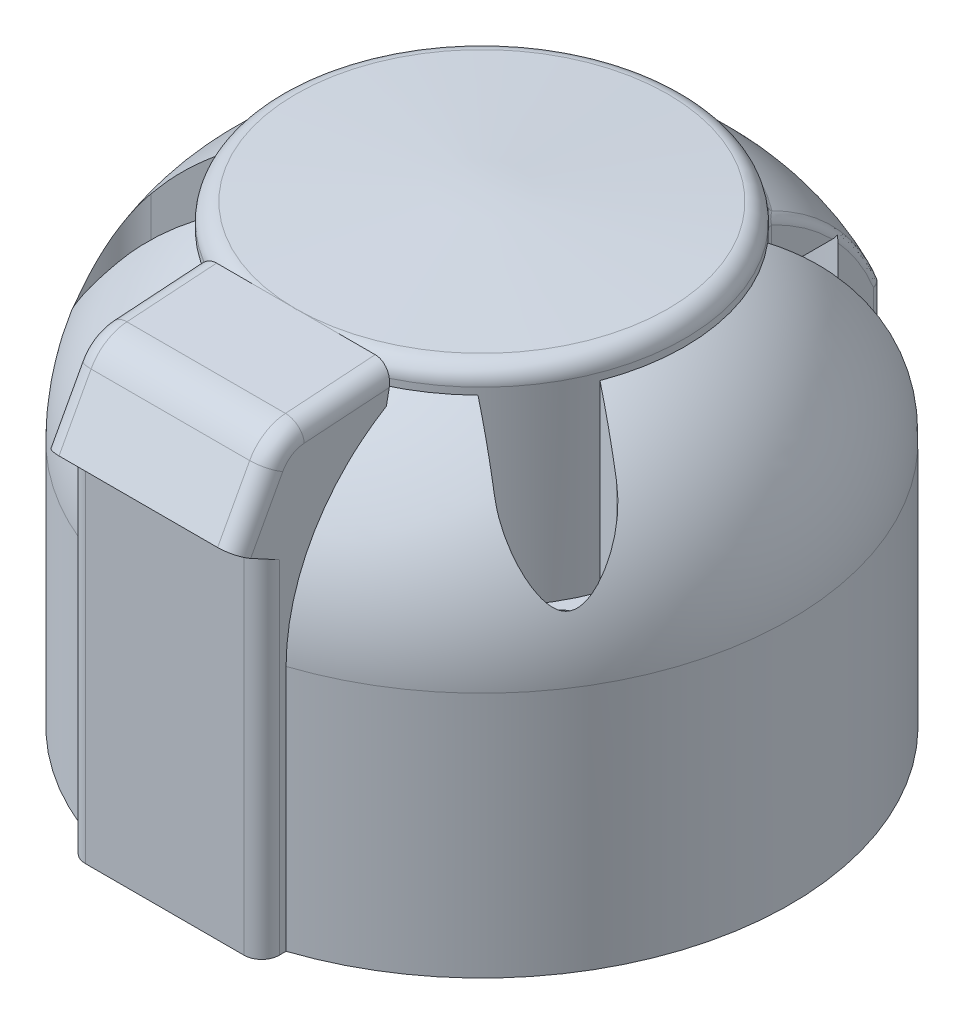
SolidWorks part; units mm, degrees
ref_plane "Face" through (0, 0, 0) normal (0, 0, 1) x (1, 0, 0)
ref_plane "Dessus" through (0, 0, 0) normal (0, 1, 0) x (1, 0, 0)
ref_plane "Droite" through (0, 0, 0) normal (1, 0, 0) x (0, 0, -1)
sketch "Esquisse1" plane through (0, 0, 0) normal (0, 0, 1) x (1, 0, 0)
  line L0 (0, 0) -> (35, 0)
  line L1 (35, 0) -> (35, 28)
  line L2 (23, 48.805) -> (23, 49.5937)
  line L3 (21.1143, 51.5904) -> (0, 53)
  line L4 (0, 53) -> (0, 0) construction
  line L5 (0, 0) -> (0, 53)
  arc A0 (35, 28) -> (23, 48.805) centre (10.9646, 28) ccw
  arc A1 (23, 49.5937) -> (21.1143, 51.5904) centre (21, 49.5937) ccw
  dimension "D5" = 2
  dimension "D1" = 35
  dimension "D2" = 28
  dimension "D3" = 53
  dimension "D4" = 23
revolve "Révolution1" add sketch "Esquisse1" angle 360 about L4
sketch "Esquisse2" plane through (0, 0, 0) normal (1, 0, 0) x (0, 0, -1)
  line L0 (-31.2808, 0) -> (-36, 0)
  line L1 (-35, 0) -> (35, 0) construction
  line L2 (-36, 0) -> (-36, 39.9562)
  line L3 (-36, 39.9562) -> (-39, 41.5809)
  line L4 (-39, 41.5809) -> (-35.3597, 48.3028)
  line L5 (-21.1143, 51.5904) -> (-31.2961, 50.9107)
  line L7 (0, 53) -> (-21.1143, 51.5904) construction
  line L8 (-21.1143, 51.5904) -> (-31.2808, 0)
  arc A0 (-35.3597, 48.3028) -> (-31.2961, 50.9107) centre (-30.963, 45.9218) cw
  dimension "D1" = 5
  dimension "D2" = 36
  dimension "D3" = 39
extrude "Extrusion1" add sketch "Esquisse2" along normal mid plane 22
fillet "Congé11" radius 2
ref_plane "Plan1" through (0, 50, 0) normal (0, 1, 0) x (-1, 0, 0)
sketch "Esquisse4" plane through (0, 50, 0) normal (0, 1, 0) x (-1, 0, 0)
  line L0 (-15, -17.4356) -> (-15, -30.4356)
  line L1 (-15, -30.4356) -> (15, -30.4356)
  line L2 (15, -30.4356) -> (15, -17.4356)
  line L3 (17.5, -14.9248) -> (27.7859, -39.9248)
  line L4 (27.7859, -39.9248) -> (-32.2141, -39.9248)
  line L5 (-32.2141, -39.9248) -> (-17.5, -14.9248)
  line L6 (-21.5179, 20.0744) -> (-16.0389, 16.4849)
  line L7 (-26.9979, 11.7096) -> (-21.5189, 8.1201)
  line L8 (22.8597, 18.532) -> (17.1447, 15.3316)
  line L9 (27.7457, 9.807) -> (22.0307, 6.6066)
  line L10 (25.3027, 14.1695) -> (0, 0) construction
  line L11 (-24.2579, 15.892) -> (0, 0) construction
  arc A0 (-8.1495, 21.5078) -> (8.1495, 21.5078) centre (0, 0) ccw construction
  arc A1 (22.0307, 6.6066) -> (17.1447, 15.3316) centre (0, 0) ccw
  arc A2 (15, -17.4356) -> (17.5, -14.9248) centre (0, 0) ccw
  arc A3 (27.7457, 9.807) -> (22.8597, 18.532) centre (25.3027, 14.1695) ccw
  arc A4 (-21.5179, 20.0744) -> (-26.9979, 11.7096) centre (-24.2579, 15.892) ccw
  arc A5 (-16.0389, 16.4849) -> (-21.5189, 8.1201) centre (0, 0) ccw
  arc A6 (-17.5, -14.9248) -> (-15, -17.4356) centre (0, 0) ccw
  dimension "D7" = 5
  dimension "D1" = 30
  dimension "D2" = 15
  dimension "D3" = 35
  dimension "D4" = 17.5
  dimension "D5" = 60
  dimension "D6" = 13
  dimension "D8" = 29
extrude "Enlèv. mat.-Extru.3" cut sketch "Esquisse4" against normal blind 22
sketch "Esquisse5" plane through (0, 0, -30.4356) normal (0, 0, -1) x (-1, 0, 0)
  line L0 (0, 28) -> (0, 48.805) construction
  line L1 (-13.2059, 28) -> (13.2059, 28)
  line L2 (22.418, 28) -> (-23.8128, 28) construction
  arc A0 (13.2059, 28) -> (-13.2059, 28) centre (0, 12.9799) ccw
  dimension "D1" = 40
extrude "Enlèv. mat.-Extru.4" cut sketch "Esquisse5" against normal blind 8
sketch "Esquisse6" plane through (0, 28, 0) normal (0, 1, 0) x (-1, 0, 0)
  line L0 (-15, -25.4018) -> (-15, -17.4356)
  line L1 (15, -25.4018) -> (15, -17.4356)
  line L2 (-15, -17.4356) -> (-15, -30.4356) construction
  line L3 (15, -30.4356) -> (15, -17.4356) construction
  arc A0 (-15, -17.4356) -> (15, -17.4356) centre (0, 0) ccw
  arc A1 (-15, -25.4018) -> (15, -25.4018) centre (0, 0) ccw
  arc A2 (-8.1495, 21.5078) -> (8.1495, 21.5078) centre (0, 0) ccw construction
  dimension "D1" = 29.5
extrude "Enlèv. mat.-Extru.6" cut sketch "Esquisse6" along normal blind 15
sketch "Esquisse7" plane through (0, 28, 0) normal (0, 1, 0) x (-1, 0, 0)
  line L0 (0, -16.9549) -> (0, -33.397) construction
  line L1 (-24.2579, 15.892) -> (0, 0) construction
  line L2 (0, 0) -> (0, -29) construction
  circle A0 centre (-24.2579, 15.892) radius 5
  circle A1 centre (25.3027, 14.1695) radius 5
  circle A2 centre (0, -29) radius 5
  arc A3 (-21.5179, 20.0744) -> (-26.9979, 11.7096) centre (-24.2579, 15.892) ccw construction
  arc A4 (27.7457, 9.807) -> (22.8597, 18.532) centre (25.3027, 14.1695) ccw construction
  dimension "D1" = 10
extrude "Enlèv. mat.-Extru.7" cut sketch "Esquisse7" against normal blind 8
sketch "Esquisse8" plane through (0, 20, 0) normal (0, 1, 0) x (-1, 0, 0)
  line L0 (0, -16.9549) -> (0, -33.397) construction
  circle A0 centre (-24.2579, 15.892) radius 3
  circle A1 centre (25.3027, 14.1695) radius 3
  circle A2 centre (0, -29) radius 3
  arc A3 (-21.5179, 20.0744) -> (-26.9979, 11.7096) centre (-24.2579, 15.892) ccw construction
  arc A4 (27.7457, 9.807) -> (22.8597, 18.532) centre (25.3027, 14.1695) ccw construction
  circle A5 centre (0, -29) radius 5 construction
  dimension "D1" = 6
extrude "Enlèv. mat.-Extru.8" cut sketch "Esquisse8" against normal blind 30
fillet "Congé12" radius 1
